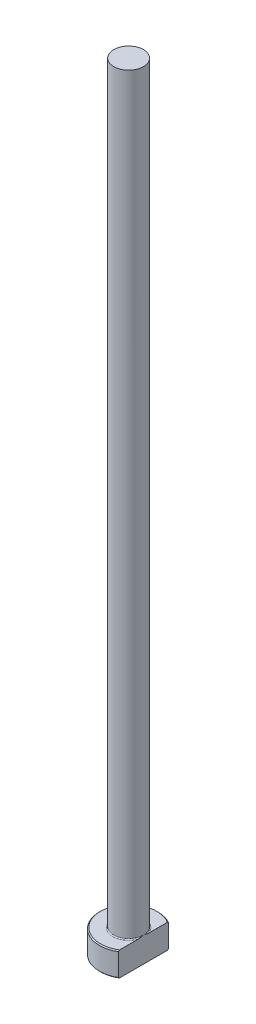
SolidWorks part; units mm, degrees
ref_plane "Front Plane" through (0, 0, 0) normal (0, 0, 1) x (1, 0, 0)
ref_plane "Top Plane" through (0, 0, 0) normal (0, 1, 0) x (1, 0, 0)
ref_plane "Right Plane" through (0, 0, 0) normal (1, 0, 0) x (0, 0, -1)
sketch "Sketch1" plane through (0, 0, 0) normal (0, 0, 1) x (1, 0, 0)
  line L0 (0, 259.9588) -> (0, -15.1925) construction
  line L1 (0, 0) -> (-6, 0)
  line L2 (-6, 0) -> (-6, 5)
  line L3 (-6, 5) -> (-3.05, 5)
  line L4 (-3.05, 5) -> (-3.05, 160)
  line L5 (-3.05, 160) -> (0, 160)
  line L6 (0, 160) -> (0, 0)
  dimension "L" = 160
  dimension "H" = 12
  dimension "T" = 5
  dimension "D" = 6.1
revolve "Revolve1" add sketch "Sketch1" angle 360 about L0
chamfer "Chamfer1" distance 0.2 angle 45 2 edges at (0, 5, 6) (0, 0, 6)
fillet "Fillet1" radius 0.2 1 edges at (0, 5, 3.05)
sketch "Sketch2" plane through (0, 0, 0) normal (0, 1, 0) x (1, 0, 0)
  line L0 (3.05, 5.167) -> (3.05, -5.167)
  circle A0 centre (0, 0) radius 6 construction
  arc A1 (3.05, -5.167) -> (3.05, 5.167) centre (0, 0) ccw
  circle A2 centre (0, 0) radius 3.05 construction
extrude "KEY" cut sketch "Sketch2" along normal through all
